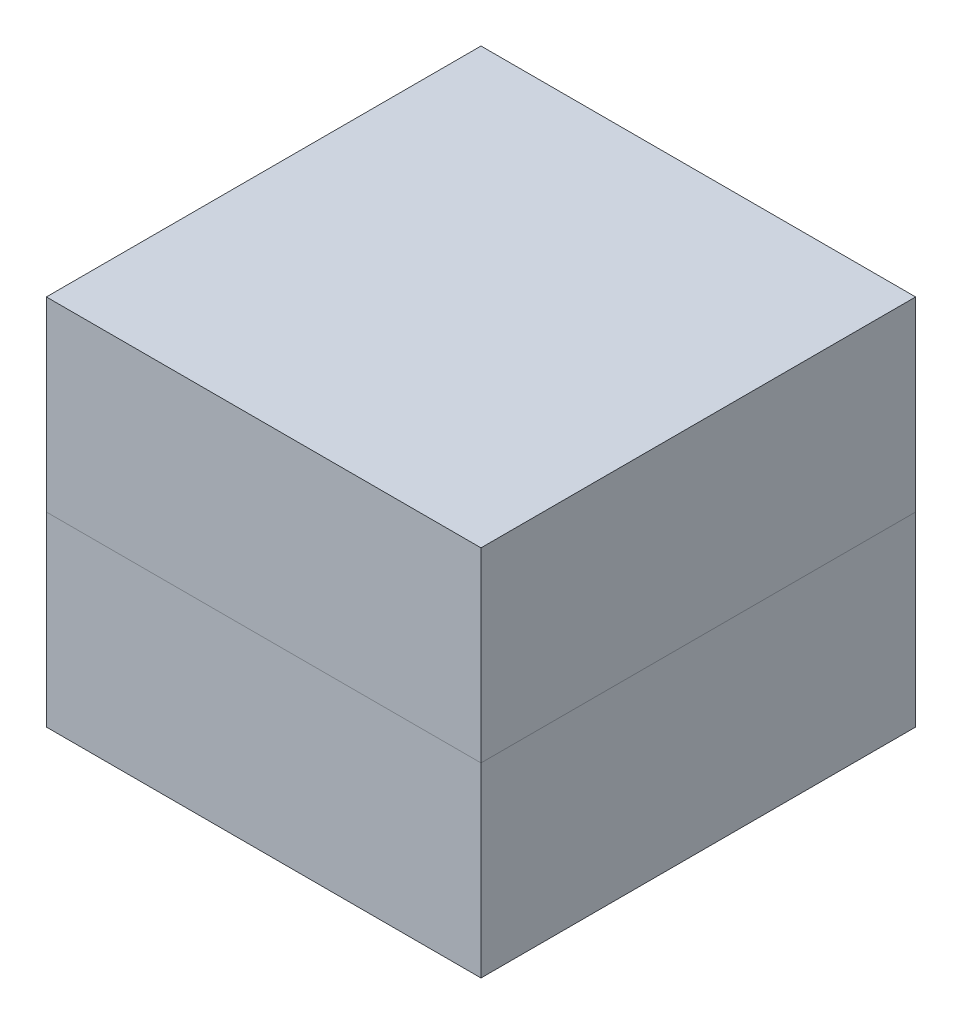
SolidWorks part; units mm, degrees
ref_plane "Front Plane" through (0, 0, 0) normal (0, 0, 1) x (1, 0, 0)
ref_plane "Top Plane" through (0, 0, 0) normal (0, 1, 0) x (1, 0, 0)
ref_plane "Right Plane" through (0, 0, 0) normal (1, 0, 0) x (0, 0, -1)
sketch "Sketch1" plane through (0, 0, 0) normal (1, 0, 0) x (0, 0, -1)
  line L0 (0, 0) -> (0, 11.8952) construction
  line L1 (0, 4) -> (7.5, 4)
  line L2 (7.5, 4) -> (10.5, 0)
  line L3 (10.5, 0) -> (13, 0)
  line L4 (13, 0) -> (8.5, 6)
  line L5 (8.5, 6) -> (0, 6)
  line L8 (0, 6) -> (0, 4)
  dimension "D1" = 13
  dimension "D2" = 6
  dimension "D4" = 2
  dimension "D5" = 2
  dimension "D6" = 8.5
revolve "Revolve1" add sketch "Sketch1" angle 360 about L0
sketch "Sketch2" plane through (0, 6, 0) normal (0, 1, 0) x (1, 0, 0)
  line L0 (0, 6.8) -> (-2.25, 3.8162)
  line L1 (-2.25, 3.8162) -> (0, 1.6)
  line L2 (0, 1.6) -> (2.25, 3.8162)
  line L3 (2.25, 3.8162) -> (0, 6.8)
  line L4 (0, 0) -> (0, 6.8) construction
  dimension "D1" = 4.5
  dimension "D2" = 5.2
  dimension "D3" = 6.8
  dimension "D4" = 2.2162
  dimension "D5" = 3.7371
extrude "Boss-Extrude1" add sketch "Sketch2" along normal blind 1 draft 20
pattern_circular "CirPattern1" count 3 over 360 about axis through (0, 0, 0) along (0, 1, 0) of "Boss-Extrude1"
fillet "Fillet1" radius 2 1 edges at (0, 6, -8.5)
fillet "Fillet2" radius 0.5 24 edges at (-2.3159, 6.5, 3.6565) (-1.6069, 6.5, 0.9277) (-4.3246, 6.5, 0.1774) (-5.6272, 6.5, 3.2489) (4.3246, 6.5, 0.1774) (1.6069, 6.5, 0.9277) (2.3159, 6.5, 3.6565) (5.6272, 6.5, 3.2489) (-2.0087, 6.5, -3.8339) (0, 6.5, -1.8554) (0, 6.5, -6.4977) (2.0087, 6.5, -3.8339) (-1.7828, 6, 2.3283) (-2.9078, 6, 0.3798) (-5.1594, 6, 1.6798) (-4.0344, 6, 3.6283) (2.9078, 6, 0.3798) (1.7828, 6, 2.3283) (4.0344, 6, 3.6283) (-1.125, 6, -2.7081) (1.125, 6, -2.7081) (1.125, 6, -5.3081) (-1.125, 6, -5.3081) (5.1594, 6, 1.6798)
sketch "Sketch3" plane through (0, 0, 0) normal (1, 0, 0) x (0, 0, -1)
  line L1 (7.5, 6) -> (-7.5, 6) construction
  line L3 (0, 0) -> (0, 6.7) construction
  line L9 (7.5, 6) -> (0, 6)
  line L12 (13, 0) -> (9.1, 5.2) construction
  line L14 (0, 6.7) -> (0, 6)
  line L15 (13, 0) -> (9.1, 5.2)
  line L16 (14.875, 0) -> (10.45, 5.9)
  line L17 (8.85, 6.7) -> (0, 6.7)
  line L18 (13, 0) -> (14.875, 0)
  line L19 (14.2, 0.9) -> (9.85, 6.7) construction
  line L20 (9.85, 6.7) -> (0, 6.7) construction
  line L21 (9.1, 5.2) -> (0, 5.2) construction
  arc A0 (10.45, 5.9) -> (8.85, 6.7) centre (8.85, 4.7) ccw
  arc A1 (9.1, 5.2) -> (7.5, 6) centre (7.5, 4) ccw construction
  arc A2 (9.1, 5.2) -> (7.5, 6) centre (7.5, 4) ccw
  dimension "D2" = 2
  dimension "D1" = 1.5
revolve "Revolve2" add sketch "Sketch3" angle 360 about L3
combine bodies "Combine1" operation type add bodies to combine 103 105
sketch "Sketch4" plane through (0, 0, 0) normal (0, 1, 0) x (1, 0, 0)
  line L1 (-17.5, -17.5) -> (17.5, -17.5)
  line L2 (-17.5, -17.5) -> (-17.5, 17.5)
  line L3 (-17.5, 17.5) -> (17.5, 17.5)
  line L4 (17.5, -17.5) -> (17.5, 17.5)
  line L5 (-17.5, -17.5) -> (17.5, 17.5) construction
  line L6 (-17.5, 17.5) -> (17.5, -17.5) construction
  point P0 (0, 0)
  dimension "D1" = 35
extrude "Boss-Extrude2" add sketch "Sketch4" along normal blind 15 separate body
combine bodies "Combine4" operation type subtract main body 107 bodies to subtract 106
sketch "Sketch5" plane through (0, 0, 0) normal (0, -1, 0) x (1, 0, 0)
  line L1 (-17.5, -17.5) -> (17.5, -17.5)
  line L2 (-17.5, -17.5) -> (-17.5, 17.5)
  line L3 (-17.5, 17.5) -> (17.5, 17.5)
  line L4 (17.5, -17.5) -> (17.5, 17.5)
  line L5 (-17.5, -17.5) -> (17.5, 17.5) construction
  line L6 (-17.5, 17.5) -> (17.5, -17.5) construction
  point P0 (0, 0)
  dimension "D1" = 35
extrude "Boss-Extrude3" add sketch "Sketch5" along normal blind 15
